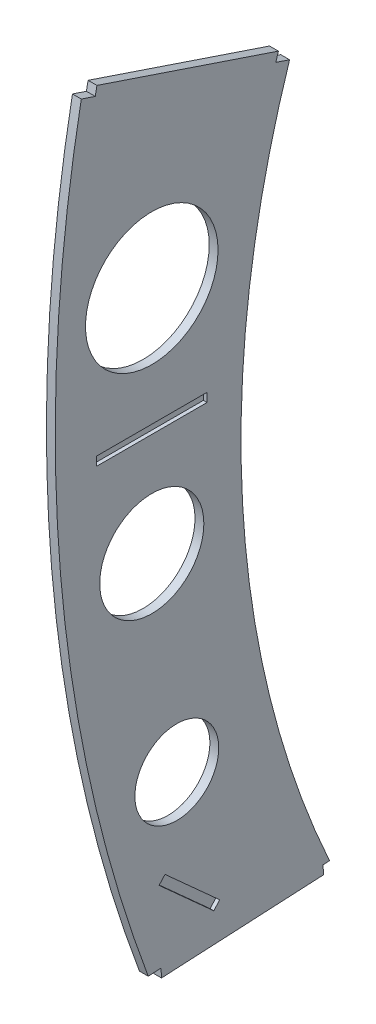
SolidWorks part; units mm, degrees
ref_plane "Front Plane" through (0, 0, 0) normal (0, 0, 1) x (1, 0, 0)
ref_plane "Top Plane" through (0, 0, 0) normal (0, 1, 0) x (1, 0, 0)
ref_plane "Right Plane" through (0, 0, 0) normal (1, 0, 0) x (0, 0, -1)
sketch "Sketch1" plane through (0, 0, 0) normal (1, 0, 0) x (0, 0, -1)
  line L0 (-0.9442, 0.3175) -> (283.4061, -95.3115)
  line L1 (375.733, -1159.6825) -> (115.733, -1159.6825)
  arc A0 (-0.9442, 0.3175) -> (115.733, -1159.6825) centre (1973.7475, -386.9284) ccw
  arc A1 (375.733, -1159.6825) -> (283.4061, -95.3115) centre (1550.8442, -521.5598) cw
  dimension "D1" = 300
  dimension "D2" = 260
  dimension "D3" = 1160
extrude "Boss-Extrude2" add sketch "Sketch1" along normal blind 12
sketch "Sketch2" plane through (12, 0, 0) normal (1, 0, 0) x (0, 0, -1)
  circle A0 centre (92.5146, -281.7476) radius 89.9841
  circle A1 centre (92.5146, -593.879) radius 70.694
  circle A2 centre (126.5008, -867.8251) radius 56.9337
extrude "Cut-Extrude1" cut sketch "Sketch2" against normal blind 14
sketch "Sketch3" plane through (12, 0, 0) normal (1, 0, 0) x (0, 0, -1)
  line L0 (-0.9442, 0.3175) -> (18.0125, -6.0577)
  line L1 (283.4061, -95.3115) -> (-0.9442, 0.3175) construction
  line L2 (18.0125, -6.0577) -> (15.7384, -17.8403)
  line L3 (15.7384, -17.8403) -> (-3.2183, -11.465)
  line L4 (-3.2183, -11.465) -> (-0.9442, 0.3175)
  arc A0 (-0.9442, 0.3175) -> (115.733, -1159.6825) centre (1973.7475, -386.9284) ccw construction
  dimension "D1" = 12
  dimension "D2" = 20
  dimension "D3" = 12
  dimension "D4" = 20
extrude "Cut-Extrude2" cut sketch "Sketch3" against normal blind 14
sketch "Sketch4" plane through (0, 0.1871, 0.9693) normal (0, -0.1895, -0.9819) x (-1, 0, 0)
  line L0 (2.8628, 3.6326) -> (-18.8412, 3.6326)
  line L1 (-18.8412, 3.6326) -> (-18.8412, -13.6431)
  line L4 (2.8628, 3.6326) -> (3.2058, -13.8667)
  line L5 (3.2058, -13.8667) -> (-18.8412, -13.6431)
extrude "Cut-Extrude3" cut sketch "Sketch4" against normal blind 14
sketch "Sketch5" plane through (12, 0, 0) normal (1, 0, 0) x (0, 0, -1)
  line L0 (283.4061, -95.3115) -> (264.4495, -88.9362)
  line L1 (283.4061, -95.3115) -> (18.0125, -6.0577) construction
  line L2 (283.4061, -95.3115) -> (279.914, -106.7921)
  line L3 (264.4495, -88.9362) -> (260.9573, -100.4168)
  line L4 (260.9573, -100.4168) -> (279.914, -106.7921)
  dimension "D1" = 20
  dimension "D2" = 12
  dimension "D3" = 12
  dimension "D4" = 20
extrude "Cut-Extrude4" cut sketch "Sketch5" against normal blind 14
sketch "Sketch6" plane through (12, 0, 0) normal (1, 0, 0) x (0, 0, -1)
  line L0 (115.733, -1159.6825) -> (135.733, -1159.6825)
  line L1 (115.733, -1159.6825) -> (375.733, -1159.6825) construction
  line L2 (135.733, -1159.6825) -> (130.8392, -1145.6825)
  line L3 (115.733, -1159.6825) -> (110.6837, -1146.6248)
  line L4 (130.8392, -1145.6825) -> (110.6837, -1146.6248)
  dimension "D1" = 20
  dimension "D2" = 14
  dimension "D3" = 14
extrude "Cut-Extrude5" cut sketch "Sketch6" against normal blind 14
sketch "Sketch7" plane through (0, -111.9211, 289.4304) normal (0, 0.3607, -0.9327) x (-1, 0, 0)
  line L0 (-12, -1109.3705) -> (3.3722, -1109.3705)
  line L1 (3.3722, -1109.3705) -> (3.3722, -1124.6061)
  line L2 (3.3722, -1124.6061) -> (-19.7085, -1124.6061)
  line L3 (-19.7085, -1124.6061) -> (-19.7085, -1109.3705)
  line L4 (-19.7085, -1109.3705) -> (-12, -1109.3705)
extrude "Cut-Extrude6" cut sketch "Sketch7" against normal blind 14
sketch "Sketch8" plane through (12, 0, 0) normal (1, 0, 0) x (0, 0, -1)
  line L0 (375.733, -1159.6825) -> (355.733, -1159.6825)
  line L1 (135.733, -1159.6825) -> (375.733, -1159.6825) construction
  line L2 (355.733, -1159.6825) -> (349.1199, -1147.3428)
  line L3 (375.733, -1159.6825) -> (369.4698, -1147.1616)
  line L4 (369.4698, -1147.1616) -> (349.1199, -1147.3428)
  dimension "D1" = 20
  dimension "D2" = 14
  dimension "D3" = 14
  dimension "D4" = 20.3498
  dimension "D5" = 20.3498
extrude "Cut-Extrude7" cut sketch "Sketch8" against normal blind 14
sketch "Sketch9" plane through (0, 0, 0) normal (-1, 0, 0) x (0, 0, 1)
  line L0 (-110.4006, -1146.7342) -> (-339.3224, -1087.5119)
  line L1 (-339.3224, -1087.5119) -> (-366.8329, -1146.4031)
  line L2 (-366.8329, -1146.4031) -> (-360.9925, -1205.1486)
  line L3 (-360.9925, -1205.1486) -> (-119.2961, -1181.1194)
  line L4 (-119.2961, -1181.1194) -> (-110.4006, -1146.7342)
  arc A0 (-369.0218, -1147.1656) -> (-279.6336, -106.6978) centre (-1550.8442, -521.5598) ccw construction
  dimension "D1" = 65
extrude "Cut-Extrude8" cut sketch "Sketch9" against normal blind 25
sketch "Sketch10" plane through (0, 0, 0) normal (-1, 0, 0) x (0, 0, 1)
  line L0 (-382.807, -1072.94) -> (-281.0064, -1108.6363)
  line L1 (-281.0064, -1108.6363) -> (-343.8054, -1186.6394)
  line L2 (-343.8054, -1186.6394) -> (-390.7395, -1154.2483)
  line L3 (-390.7395, -1154.2483) -> (-382.807, -1072.94)
extrude "Cut-Extrude9" cut sketch "Sketch10" against normal blind 25
sketch "Sketch11" plane through (0, -64.6899, 138.4802) normal (0, -0.4232, 0.906) x (1, 0, 0)
  line L0 (12, -1128.92) -> (12, -1129.561) construction
  line L1 (0, -1128.92) -> (12, -1128.92)
  line L2 (0, -1128.92) -> (0, -1129.561)
  line L3 (0, -1129.561) -> (12, -1129.561)
  line L4 (12, -1128.92) -> (12, -1129.561)
  line L5 (0, -1129.561) -> (12, -1129.561) construction
extrude "Cut-Extrude10" cut sketch "Sketch11" against normal blind 25
sketch "Sketch12" plane through (0, 0, 0) normal (-1, 0, 0) x (0, 0, 1)
  line L0 (-339.3224, -1087.5119) -> (-92.123, -1100.2698)
  line L1 (-92.123, -1100.2698) -> (-118.1505, -1168.924)
  line L2 (-118.1505, -1168.924) -> (-339.3224, -1087.5119)
  arc A0 (-110.4006, -1146.7342) -> (3.2183, -11.465) centre (-1973.7475, -386.9284) ccw construction
extrude "Cut-Extrude11" cut sketch "Sketch12" against normal blind 25
sketch "Sketch14" plane through (0, 0, 0) normal (-1, 0, 0) x (0, 0, 1)
  line L0 (-325.1034, -1076.2138) -> (-105.1034, -1087.5679)
  line L1 (-92.123, -1100.2698) -> (-339.3224, -1087.5119) construction
  line L2 (-215.7227, -1093.8908) -> (-214.1347, -1063.1217) construction
  line L3 (-105.7227, -1099.5679) -> (-105.1034, -1087.5679)
  line L4 (-325.7227, -1088.2138) -> (-325.1034, -1076.2138)
  line L5 (-325.1034, -1076.2138) -> (-361.2598, -1074.3478)
  line L6 (-105.1034, -1087.5679) -> (-59.3249, -1089.9305)
  line L7 (-361.2598, -1074.3478) -> (-361.2598, -1119.4181)
  line L8 (-325.7227, -1088.2138) -> (-327.1477, -1115.8239)
  line L9 (-327.1477, -1115.8239) -> (-361.2598, -1119.4181)
  line L10 (-105.7227, -1099.5679) -> (-107.5166, -1134.3263)
  line L11 (-59.3249, -1089.9305) -> (-107.5166, -1134.3263)
  dimension "D1" = 12
  dimension "D2" = 90
  dimension "D3" = 90
  dimension "D4" = 110
  dimension "D5" = 12
extrude "Cut-Extrude14" cut sketch "Sketch14" against normal blind 25 contours L4 L5 M17 M10 | L6 L3 M10 M11
sketch "Sketch17" plane through (0, 0, 0) normal (-1, 0, 0) x (0, 0, 1)
  line L1 (-167.5146, -441.7317) -> (-17.5146, -441.7317)
  line L2 (-167.5146, -441.7317) -> (-167.5146, -453.7317)
  line L3 (-167.5146, -453.7317) -> (-17.5146, -453.7317)
  line L4 (-17.5146, -441.7317) -> (-17.5146, -453.7317)
  line L6 (-92.5146, -371.7317) -> (-92.5146, -523.1849) construction
  circle A0 centre (-92.5146, -281.7476) radius 89.9841 construction
  circle A1 centre (-92.5146, -593.879) radius 70.694 construction
  dimension "D1" = 12
  dimension "D2" = 70
  dimension "D3" = 150
  dimension "D4" = 75
extrude "Cut-Extrude17" cut sketch "Sketch17" against normal blind 7
sketch "Sketch18" plane through (0, 0, 0) normal (-1, 0, 0) x (0, 0, 1)
  line L0 (-102.4371, -989.0314) -> (-176.6983, -1056.0036)
  line L2 (-184.735, -1047.0923) -> (-110.4738, -980.1201)
  line L3 (-110.4738, -980.1201) -> (-102.4371, -989.0314)
  line L4 (-105.7227, -1099.5679) -> (-325.7227, -1088.2138) construction
  line L5 (-184.735, -1047.0923) -> (-176.6983, -1056.0036)
  dimension "D1" = 100
  dimension "D2" = 135
  dimension "D3" = 12
  dimension "D4" = 12
extrude "Cut-Extrude18" cut sketch "Sketch18" against normal blind 7
sketch "Sketch19" plane through (0, 0, 0) normal (-1, 0, 0) x (0, 0, 1)
  line L0 (-167.5146, -441.7317) -> (-167.5146, -453.7317)
  line L1 (-167.5146, -453.7317) -> (-17.5146, -453.7317)
  line L2 (-17.5146, -453.7317) -> (-17.5146, -441.7317)
  line L3 (-17.5146, -441.7317) -> (-167.5146, -441.7317)
extrude "Cut-Extrude19" cut sketch "Sketch19" against normal blind 25
sketch "Sketch20" plane through (0, 0, 0) normal (-1, 0, 0) x (0, 0, 1)
  line L0 (-167.5146, -441.7317) -> (-167.5146, -453.7317)
  line L1 (-167.5146, -453.7317) -> (-17.5146, -453.7317)
  line L2 (-17.5146, -453.7317) -> (-17.5146, -441.7317)
  line L3 (-17.5146, -441.7317) -> (-167.5146, -441.7317)
extrude "Boss-Extrude3" add sketch "Sketch20" against normal blind 7
sketch "Sketch21" plane through (0, 0, 0) normal (-1, 0, 0) x (0, 0, 1)
  line L0 (-184.735, -1047.0923) -> (-176.6983, -1056.0036)
  line L1 (-176.6983, -1056.0036) -> (-102.4371, -989.0314)
  line L2 (-102.4371, -989.0314) -> (-110.4738, -980.1201)
  line L3 (-110.4738, -980.1201) -> (-184.735, -1047.0923)
extrude "Cut-Extrude23" cut sketch "Sketch21" against normal blind 14
sketch "Sketch22" plane through (0, 0, 0) normal (-1, 0, 0) x (0, 0, 1)
  line L0 (-184.735, -1047.0923) -> (-176.6983, -1056.0036)
  line L1 (-176.6983, -1056.0036) -> (-102.4371, -989.0314)
  line L2 (-102.4371, -989.0314) -> (-110.4738, -980.1201)
  line L3 (-110.4738, -980.1201) -> (-184.735, -1047.0923)
extrude "Boss-Extrude4" add sketch "Sketch22" against normal blind 7
